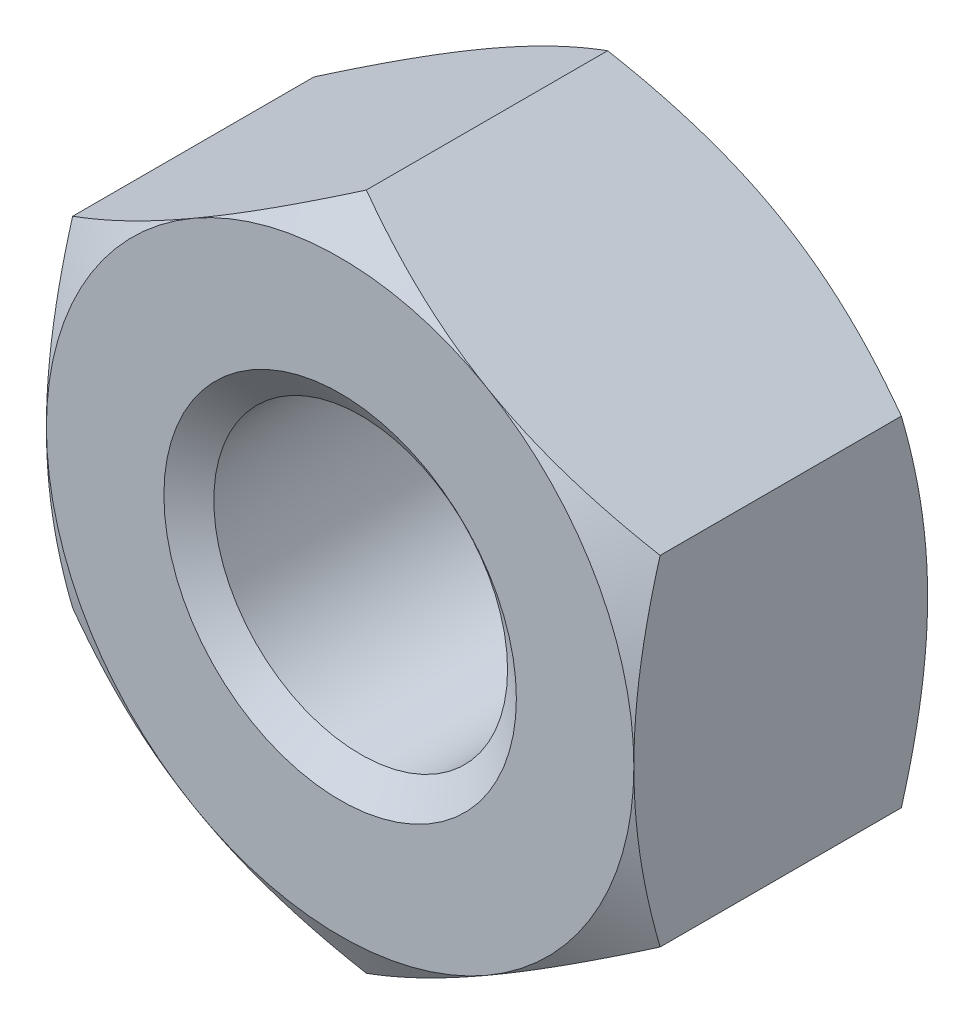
SolidWorks part; units mm, degrees
ref_plane "Plane1" through (0, 0, 0) normal (0, 0, 1) x (1, 0, 0)
ref_plane "Plane2" through (0, 0, 0) normal (0, 1, 0) x (1, 0, 0)
ref_plane "Plane3" through (0, 0, 0) normal (1, 0, 0) x (0, 0, -1)
revolve "EndChamfer" cut sketch "Sketch5"
sketch "Sketch5"
  line L0 (4.9746, 3) -> (4.5895, 2.45)
  line L1 (5.0254, 3) -> (4.9746, 3)
  line L2 (5.0254, 3) -> (5.0254, 2.45)
  line L3 (5.0254, 2.45) -> (4.5895, 2.45)
  line L6 (-0.0508, 3) -> (0, 3)
  line L7 (0, 3) -> (0.3851, 2.45)
  line L9 (0.3851, 2.45) -> (-0.0508, 2.45)
  line L10 (-0.0508, 2.45) -> (-0.0508, 3)
  line L11 (25.0375, 0) -> (38.388, 0) construction
  line L12 (5, 0) -> (0, 0) construction
extrude "BaseNut" add sketch "BaseNutSke" against normal blind 5
sketch "BaseNutSke" plane through (0, 0, 0) normal (0, 0, 1) x (1, 0, 0)
  line L6 (5, 2.8868) -> (5, -2.8868)
  line L7 (-5, 2.8868) -> (-5, -2.8868)
  line L8 (5, 2.8868) -> (0, 5.7735)
  line L9 (0, 5.7735) -> (-5, 2.8868)
  line L10 (-5, -2.8868) -> (0, -5.7735)
  line L11 (0, -5.7735) -> (5, -2.8868)
  circle A0 centre (0, 0) radius 2.5
  dimension "D4" = 5
  dimension "Tap_drill" = 5
  dimension "D1" = 120
  dimension "D2" = 5
  dimension "D3" = 5
  dimension "Width_flats" = 10
pattern_linear "ThdSchPat" [suppressed]
revolve "ThreadSchematic" cut sketch "ThdSchSke" angle 360 about L11
sketch "ThdSchSke" plane through (0, 0, 0) normal (0, 1, 0) x (1, 0, 0)
  line L0 (-3, 0.0254) -> (-2.5, 0.3755)
  line L1 (-2.5, 0.3755) -> (-1.25, 0.3755)
  line L2 (-1.25, 0.3755) -> (-1.25, -0.3247)
  line L3 (-1.25, -0.3247) -> (-2.5, -0.3247)
  line L4 (-2.5, -0.3247) -> (-3, 0.0254)
  line L5 (-3.175, 1) -> (3.175, 1) construction
  line L6 (0, 1) -> (0, -2.9874) construction
  line L7 (0, 4.6245) -> (0, 0.3501) construction
  dimension "D1" = 35
  dimension "VeeAngle" = 70
  dimension "SideAngle" = 55
  dimension "D2" = 0.0508
  dimension "OverCut" = 2.5
  dimension "Tap_Drill" = 5
  dimension "Advance" = 0.9898
  dimension "Thread_major" = 6
  dimension "Num_threads" = 6
  dimension "D4" = 50
  dimension "Offset1" = 5.0254
  dimension "ThreadMajor" = 3
  dimension "ChamferDepth" = 0.55
  dimension "Offset2" = 5.0762
sketch "Sketch4" plane through (0, 0, 0) normal (1, 0, 0) x (0, 0, -1)
  line L0 (5, 5) -> (4.99, 5)
  line L1 (5, 5) -> (5, 15.7735)
  line L2 (4.99, 15.7735) -> (5, 15.7735)
  line L3 (4.99, 15.7735) -> (4.99, 5)
  line L4 (0, 0) -> (34.925, 0) construction
  line L6 (5, 2.8868) -> (5, 5.7735) construction
  line L7 (0, 5) -> (-10, 5)
  line L8 (0, 2.8868) -> (0, 5.7735) construction
  line L9 (0.4466, 5.7735) -> (0.4466, 15.7735)
  line L10 (0.4466, 15.7735) -> (-10, 15.7735)
  line L11 (-10, 15.7735) -> (-10, 5)
  line L12 (0, 5) -> (0.4466, 5.7735)
  line L14 (0, 2.8868) -> (0, -2.8868) construction
  line L15 (5, 5.7735) -> (0, 5.7735) construction
  dimension "D1" = 5
  dimension "D2" = 30
  dimension "Bearing_ht" = 0.01
  dimension "D3" = 10
  dimension "D4" = 10
revolve "Bearing-Face" [suppressed] cut sketch "Sketch4" angle 360 about L4
sketch "Sketch3" plane through (0, 0, 0) normal (1, 0, 0) x (0, 0, -1)
  line L0 (5, 5) -> (4.5534, 5.7735)
  line L1 (4.5534, 5.7735) -> (4.5534, 15.7735)
  line L2 (4.5534, 15.7735) -> (15, 15.7735)
  line L3 (15, 15.7735) -> (15, 5)
  line L4 (15, 5) -> (5, 5)
  line L5 (5, 2.8868) -> (5, 5.7735) construction
  line L6 (5, 5.7735) -> (0, 5.7735) construction
  line L7 (0, 0) -> (38.6776, 0) construction
  line L8 (5, 0) -> (0, 0) construction
  line L9 (2.5, 5.7735) -> (2.5, 44.222) construction
  line L10 (0.4466, 15.7735) -> (-10, 15.7735)
  line L11 (-10, 15.7735) -> (-10, 5)
  line L12 (-10, 5) -> (0, 5)
  line L13 (0, 5) -> (0.4466, 5.7735)
  line L14 (0.4466, 5.7735) -> (0.4466, 15.7735)
  line L16 (5, 5.7735) -> (0, 5.7735) construction
  dimension "D1" = 5
  dimension "D2" = 30
  dimension "D3" = 10
  dimension "D4" = 10
revolve "Double-Chamfer" cut sketch "Sketch3" angle 360 about L7
equation "\"D2@BaseNutSke\" = \"Width_flats@BaseNutSke\" / 2"
equation "\"D3@BaseNutSke\" = \"Width_flats@BaseNutSke\" / 2"
equation "\"D1@Sketch3\" = \"Width_flats@BaseNutSke\" /2"
equation "\"D1@Sketch4\" = \"D2@BaseNutSke\""
equation "\"D4@BaseNutSke\" = \"D3@BaseNutSke\""
equation "\"Thread_major@ThdSchSke\" = \"Thread_major@ThreadCosmetic\""
equation "\"Tap_drill@ThdSchSke\" = \"Tap_drill@BaseNutSke\""
equation "\"Overcut@ThdSchSke\" = \"Tap_drill@ThdSchSke\" * 0.5"
equation "\"Num_threads@ThdSchPat\" = int(  ( \"Thickness@BaseNut\" - 0.0508 ) / \"Advance@ThdSchSke\" + 0.999 )  + 1"
equation "\"Advance@ThdSchPat\" = ( \"Thickness@BaseNut\" - 0.0508 ) /  (\"Num_threads@ThdSchPat\" - 1) 'relax it"
equation "' \"Num_threads@ThdSchPat\" = \"Num_threads@ThdSchPat\" - sgn( \"Num_threads@ThdSchPat\" - 1) '---chamfered tips only---"
equation "\"ThreadMajor@Sketch5\" = \"Thread_major@ThreadCosmetic\" * 0.5"
equation "\"ChamferDepth@Sketch5\" = (\"Thread_major@ThreadCosmetic\" - \"Tap_drill@BaseNutSke\") * 0.55"
equation "\"Offset1@Sketch5\" = \"Thickness@BaseNut\" + 0.0254"
equation "\"Offset2@Sketch5\" = \"Offset1@Sketch5\" + 0.0508"
